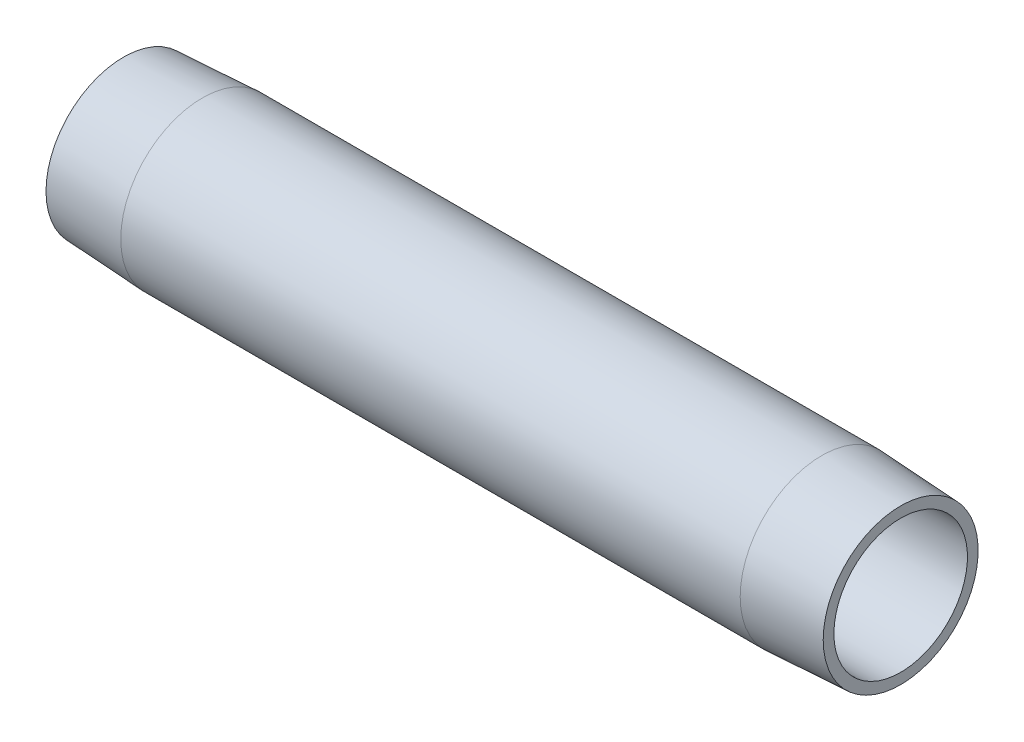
SolidWorks part; units mm, degrees
ref_plane "Front Plane" through (0, 0, 0) normal (0, 0, 1) x (1, 0, 0)
ref_plane "Top Plane" through (0, 0, 0) normal (0, 1, 0) x (1, 0, 0)
ref_plane "Right Plane" through (0, 0, 0) normal (1, 0, 0) x (0, 0, -1)
sketch "Sketch1" plane through (0, 0, 0) normal (0, 0, 1) x (1, 0, 0)
  line L6 (101.6, 8.7313) -> (0, 8.7313)
  line L7 (10.3124, 10.668) -> (0, 10.1276)
  line L8 (91.2876, 10.668) -> (10.3124, 10.668)
  line L9 (101.6, 10.1276) -> (91.2876, 10.668)
  line L10 (101.6, 8.7313) -> (101.6, 10.1276)
  line L11 (0, 10.1276) -> (0, 8.7313)
  line L12 (0, 0) -> (50000, 0) construction
  line L13 (0, -55) -> (0, 55) construction
  dimension "D1" = 101.6
  dimension "D2" = 3
  dimension "D3" = 3
  dimension "D4" = 21.336
  dimension "D5" = 17.4625
  dimension "D6" = 10.3124
  dimension "D7" = 10.3124
revolve "Revolve1" add sketch "Sketch1" angle 360 about L12
